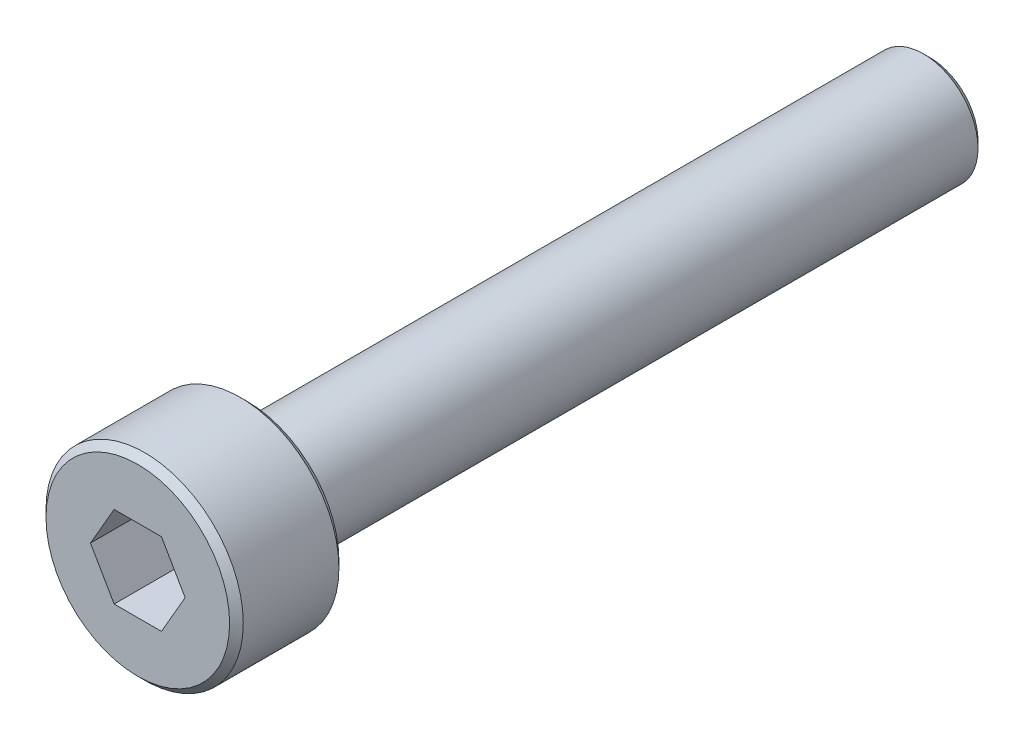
SolidWorks part; units mm, degrees
ref_plane "Front Plane" through (0, 0, 0) normal (1, 0, 0) x (0, 1, 0)
ref_plane "Top Plane" through (0, 0, 0) normal (0, 0, 1) x (0, 1, 0)
ref_plane "Right Plane" through (0, 0, 0) normal (0, 1, 0) x (-1, 0, 0)
sketch "Sketch1" plane through (0, 0, 0) normal (0, 0, 1) x (0, 1, 0)
  circle A0 centre (0, 0) radius 2
  dimension "D1" = 4
extrude "Boss-Extrude1" add sketch "Sketch1" along normal blind 25
sketch "Sketch2" plane through (0, 0, 25) normal (0, 0, 1) x (1, 0, 0)
  circle A0 centre (0, 0) radius 3.61
  dimension "D1" = 7.22
extrude "Boss-Extrude2" add sketch "Sketch2" along normal blind 4
sketch "Sketch3" plane through (0, 0, 29) normal (0, 0, 1) x (1, 0, 0)
  line L1 (1.7321, 0) -> (0.866, 1.5)
  line L2 (0.866, 1.5) -> (-0.866, 1.5)
  line L3 (-0.866, 1.5) -> (-1.7321, 0)
  line L4 (-1.7321, 0) -> (-0.866, -1.5)
  line L5 (-0.866, -1.5) -> (0.866, -1.5)
  line L6 (0.866, -1.5) -> (1.7321, 0)
  circle A0 centre (0, 0) radius 1.5 construction
  dimension "D1" = 3
extrude "Cut-Extrude1" cut sketch "Sketch3" against normal blind 2.5
chamfer "Chamfer1" distance 0.25 angle 45 3 edges at (2, 0, 0) (3.61, 0, 25) (3.61, 0, 29)
